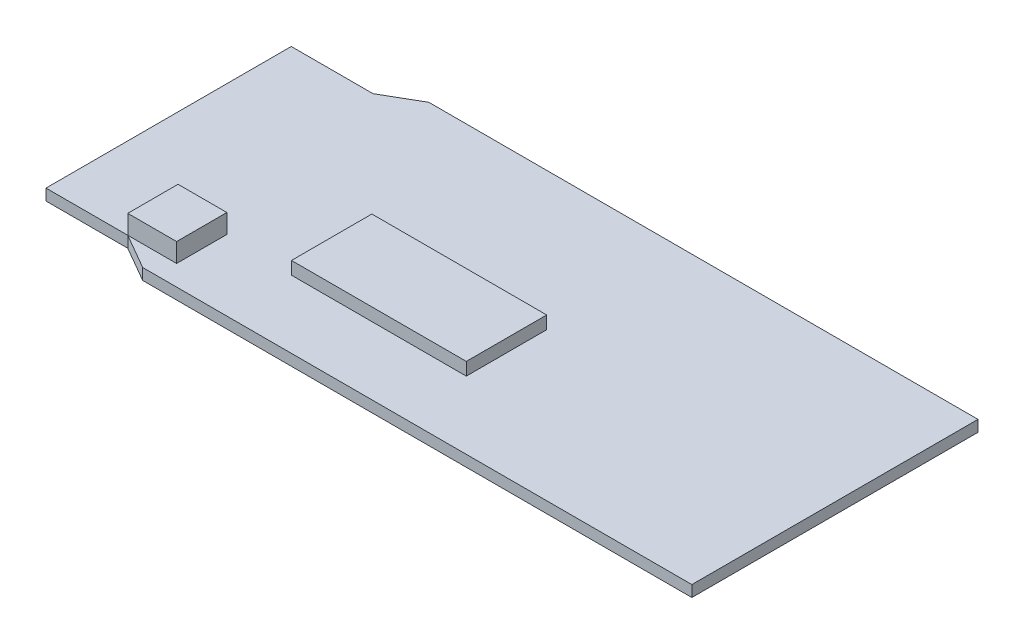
SolidWorks part; units mm, degrees
ref_plane "Front Plane" through (0, 0, 0) normal (0, 0, 1) x (1, 0, 0)
ref_plane "Top Plane" through (0, 0, 0) normal (0, 1, 0) x (1, 0, 0)
ref_plane "Right Plane" through (0, 0, 0) normal (1, 0, 0) x (0, 0, -1)
sketch "Sketch1" plane through (0, 0, 0) normal (0, 1, 0) x (1, 0, 0)
  line L0 (0, 17.78) -> (34.4661, 17.78) construction
  line L1 (10.16, 33.02) -> (0, 33.02)
  line L2 (0, 2.54) -> (0, 33.02)
  line L3 (14.5594, 35.56) -> (82.804, 35.56)
  line L4 (82.804, 0) -> (82.804, 35.56)
  line L5 (-11.2168, 2.54) -> (26.3085, 2.54) construction
  line L6 (10.16, 51.5972) -> (10.16, -58.5312) construction
  line L7 (10.16, 2.54) -> (14.5594, 0)
  line L8 (10.16, 2.54) -> (0, 2.54)
  line L9 (14.5594, 0) -> (82.804, 0)
  line L10 (10.16, 33.02) -> (14.5594, 35.56)
  dimension "D4" = 10.16
extrude "Extrude1" add sketch "Sketch1" along normal blind 1.397
sketch "Sketch2" plane through (0, 1.397, 0) normal (0, 1, 0) x (-1, 0, 0)
  line L0 (-18.288, -46.6784) -> (-18.288, 9.7365) construction
  line L1 (0, -33.02) -> (0, -2.54) construction
  line L2 (4.9025, -33.9852) -> (-41.2209, -33.9852) construction
  line L3 (-82.804, -35.56) -> (-14.5594, -35.56) construction
  circle A0 centre (-18.288, -33.9852) radius 1.4224
  dimension "D3" = 2.8448
  dimension "D1" = 18.288
  dimension "D2" = 1.5748
extrude "Cut-Extrude1" [suppressed] cut sketch "Sketch2" against normal through all
sketch "Sketch3" plane through (0, 1.397, 0) normal (0, 1, 0) x (-1, 0, 0)
  line L1 (-10.16, -2.54) -> (-16.2306, -2.54)
  line L2 (-10.16, -2.54) -> (-10.16, -8.7884)
  line L3 (-10.16, -8.7884) -> (-16.2306, -8.7884)
  line L4 (-16.2306, -2.54) -> (-16.2306, -8.7884)
  dimension "D1" = 6.0706
  dimension "D2" = 6.2484
extrude "Extrude2" add sketch "Sketch3" along normal blind 2.3622
sketch "Sketch4" plane through (0, 1.397, 0) normal (0, 1, 0) x (-1, 0, 0)
  line L1 (-24.6287, -18.4086) -> (-46.3558, -18.4086)
  line L2 (-24.6287, -18.4086) -> (-24.6287, -8.4158)
  line L3 (-24.6287, -8.4158) -> (-46.3558, -8.4158)
  line L4 (-46.3558, -18.4086) -> (-46.3558, -8.4158)
extrude "Extrude4" add sketch "Sketch4" along normal blind 1.5875
sketch "Sketch5"
